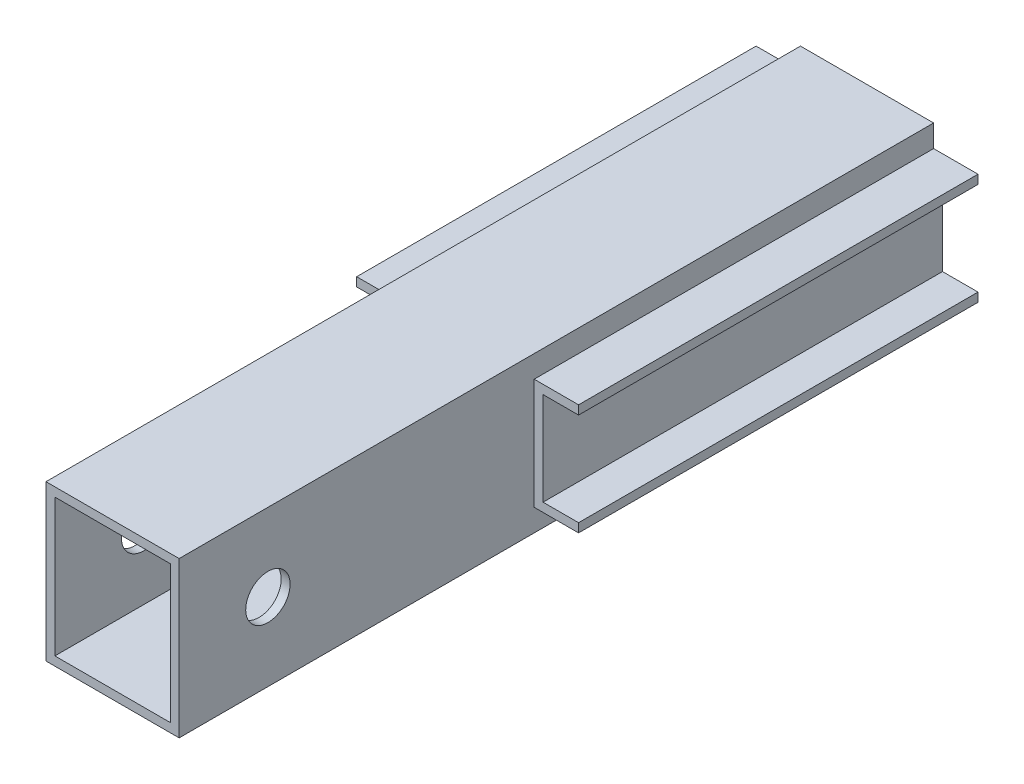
SolidWorks part; units mm, degrees
ref_plane "Face" through (0, 0, 0) normal (0, 0, 1) x (1, 0, 0)
ref_plane "Dessus" through (0, 0, 0) normal (0, 1, 0) x (1, 0, 0)
ref_plane "Droite" through (0, 0, 0) normal (1, 0, 0) x (0, 0, -1)
sketch "Esquisse1" plane through (0, 0, 0) normal (0, 0, 1) x (1, 0, 0)
  line L1 (-15, 17.5) -> (15, 17.5)
  line L2 (-15, 17.5) -> (-15, -17.5)
  line L3 (-15, -17.5) -> (15, -17.5)
  line L4 (15, 17.5) -> (15, -17.5)
  line L5 (-13, 15.5) -> (13, 15.5)
  line L6 (-13, 15.5) -> (-13, -15.5)
  line L7 (-13, -15.5) -> (13, -15.5)
  line L8 (13, 15.5) -> (13, -15.5)
  point P18 (15, 17.5)
  point P26 (-15, 17.5)
  dimension "D1" = 30
  dimension "D2" = 15
  dimension "D3" = 17.5
  dimension "D4" = 35
  dimension "D5" = 2
  dimension "D6" = 2
  dimension "D7" = 2
  dimension "D8" = 2
extrude "Base-Extrusion" add sketch "Esquisse1" along normal mid plane 1060
sketch "Esquisse2" plane through (0, 0, 0) normal (0, 0, 1) x (1, 0, 0)
  line L0 (15, 12.5) -> (15, -12.5)
  line L2 (15, -12.5) -> (25, -12.5)
  line L3 (25, -12.5) -> (25, -10.5)
  line L4 (25, -10.5) -> (17, -10.5)
  line L5 (17, -10.5) -> (17, 10.5)
  line L6 (17, 10.5) -> (25, 10.5)
  line L7 (25, 10.5) -> (25, 12.5)
  line L8 (25, 12.5) -> (15, 12.5)
  line L10 (15, -17.5) -> (15, 17.5) construction
  dimension "D1" = 2
  dimension "D2" = 2
  dimension "D3" = 25
  dimension "D4" = 25
  dimension "D5" = 12.5
  dimension "D6" = 25
  dimension "D7" = 2
extrude "Boss.-Extru.1" add sketch "Esquisse2" along normal mid plane 900
sketch "Esquisse3" plane through (15, 0, 0) normal (1, 0, 0) x (0, 0, -1)
  line L0 (530, -15.5) -> (530, 15.5) construction
  line L1 (480, -15) -> (600, -15)
  line L2 (480, -15) -> (480, 15)
  line L3 (480, 15) -> (600, 15)
  line L4 (600, -15) -> (600, 15)
  line L5 (530, -17.5) -> (530, 17.5) construction
  dimension "D1" = 30
  dimension "D2" = 15
  dimension "D3" = 120
  dimension "D4" = 50
extrude "Boss.-Extru.2" add sketch "Esquisse3" along normal blind 10
mirror "Symétrie1" about plane through (0, 0, 0) normal (1, 0, 0)
sketch "Esquisse4" plane through (25, 0, 0) normal (1, 0, 0) x (0, 0, -1)
  line L0 (600, -15) -> (600, 15) construction
  line L1 (480, -15) -> (600, -15) construction
  circle A0 centre (580, 0) radius 6
  dimension "D1" = 12
  dimension "D2" = 20
  dimension "D3" = 15
extrude "Enlèv. mat.-Extru.1" cut sketch "Esquisse4" against normal through all
sketch "Esquisse7" plane through (15, 0, 0) normal (1, 0, 0) x (0, 0, -1)
  line L0 (-530, -17.5) -> (-530, 17.5) construction
  circle A0 centre (-510, 0) radius 5
  dimension "D1" = 10
  dimension "D2" = 20
extrude "Enlèv. mat.-Extru.2" cut sketch "Esquisse7" against normal through all
sketch "Esquisse8" plane through (0, 17.5, 0) normal (0, 1, 0) x (-1, 0, 0)
  line L0 (-15, 530) -> (15, 530) construction
  line L1 (-51.1433, 360) -> (78.8567, 360)
  line L2 (-51.1433, 360) -> (-51.1433, -690)
  line L3 (-51.1433, -690) -> (78.8567, -690)
  line L4 (78.8567, 360) -> (78.8567, -690)
  dimension "D1" = 170
extrude "Enlèv. mat.-Extru.3" cut sketch "Esquisse8" against normal through all
